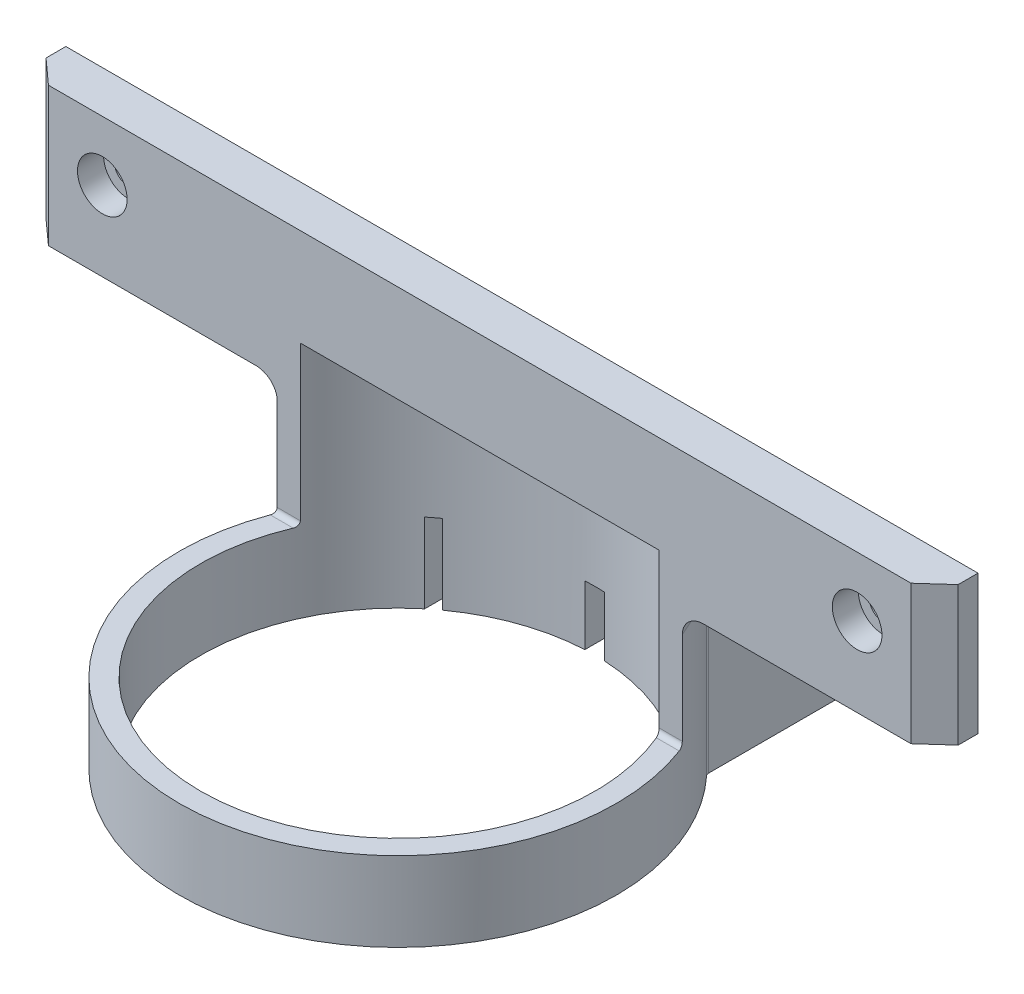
SolidWorks part; units mm, degrees
ref_plane "Front" through (0, 0, 0) normal (0, 0, 1) x (1, 0, 0)
ref_plane "Top" through (0, 0, 0) normal (0, 1, 0) x (1, 0, 0)
ref_plane "Right" through (0, 0, 0) normal (1, 0, 0) x (0, 0, -1)
ref_plane "Plane1" through (0, -72.898, 0) normal (0, 1, 0) x (-1, 0, 0)
sketch "Sketch1" plane through (0, -72.898, 0) normal (0, 1, 0) x (-1, 0, 0)
  line L0 (-23.141, 0) -> (-72.898, 0)
  line L1 (23.141, 0) -> (72.898, 0)
  line L2 (72.898, 0) -> (72.898, 3.175)
  line L3 (-72.898, 0) -> (-72.898, 3.175)
  line L4 (72.898, 3.175) -> (68.9303, 6.7475)
  line L5 (-72.898, 3.175) -> (-68.9303, 6.7475)
  line L6 (-68.9303, 6.7475) -> (68.9303, 6.7475)
  line L7 (-23.141, 0) -> (23.141, 0)
  dimension "D1" = 222
  dimension "D6" = 222
  dimension "D2" = 72.898
  dimension "D3" = 72.898
  dimension "D4" = 3.175
  dimension "D5" = 3.175
  dimension "D7" = 6.7475
extrude "Extrude1" add sketch "Sketch1" against normal blind 20.32
sketch "Sketch2" plane through (0, -93.218, 0) normal (0, -1, 0) x (1, 0, 0)
  line L0 (-68.9303, 6.7475) -> (68.9303, 6.7475) construction
  line L1 (-32.3792, 6.7475) -> (-28.675, 6.7475)
  line L2 (72.898, 0) -> (-72.898, 0) construction
  line L3 (28.675, 6.7475) -> (32.3792, 6.7475)
  arc A0 (-28.675, 6.7475) -> (28.675, 6.7475) centre (0, 19.8374) ccw
  arc A1 (-32.3792, 6.7475) -> (32.3792, 6.7475) centre (0, 19.8374) ccw
  point P5 (0, 0)
  dimension "D1" = 63.0428
  dimension "D2" = 69.85
  dimension "D6" = 19.8374
extrude "Extrude2" add sketch "Sketch2" along normal blind 20.6375
sketch "Sketch16" plane through (0, -93.218, 0) normal (0, -1, 0) x (1, 0, 0)
  line L2 (28.675, 6.7475) -> (-28.675, 6.7475)
  line L3 (-24.4965, 0) -> (24.4965, 0)
  line L4 (28.675, 6.7475) -> (-28.675, 6.7475)
  line L5 (-24.4965, 0) -> (24.4965, 0)
  arc A2 (24.4965, 0) -> (28.675, 6.7475) centre (0, 19.8374) ccw
  arc A3 (-28.675, 6.7475) -> (-24.4965, 0) centre (0, 19.8374) ccw
  arc A4 (24.4965, 0) -> (28.675, 6.7475) centre (0, 19.8374) ccw
  arc A5 (-28.675, 6.7475) -> (-24.4965, 0) centre (0, 19.8374) ccw
  dimension "D1" = 0
extrude "Extrude13" cut sketch "Sketch16" against normal blind 4.7625
sketch "Sketch17" plane through (0, -93.218, 0) normal (0, 1, 0) x (1, 0, 0)
  line L2 (24.4965, 0) -> (28.7443, 0)
  line L3 (-28.7443, 0) -> (-24.4965, 0)
  line L4 (24.4965, 0) -> (28.7443, 0)
  line L5 (-28.7443, 0) -> (-24.4965, 0)
  arc A2 (28.7443, 0) -> (-28.7443, 0) centre (0, -19.8374) ccw
  arc A3 (24.4965, 0) -> (-24.4965, 0) centre (0, -19.8374) ccw
  arc A4 (28.7443, 0) -> (-28.7443, 0) centre (0, -19.8374) ccw
  arc A5 (24.4965, 0) -> (-24.4965, 0) centre (0, -19.8374) ccw
  dimension "D1" = 0
extrude "Extrude14" add sketch "Sketch17" along normal up to surface (4.7625 mm away)
sketch "Sketch6" plane through (0, -113.8555, 0) normal (0, -1, 0) x (1, 0, 0)
  line L0 (0, -25.4) -> (25.4, -25.4) construction
  line L1 (0, -25.4) -> (-25.4, -25.4) construction
  line L2 (0, -17.4625) -> (0, 0) construction
  line L3 (-19.6616, -22.225) -> (19.6616, -22.225) construction
  line L4 (-25.4, -25.4) -> (-25.4, -4.1333) construction
  line L5 (25.4, -25.4) -> (25.4, -4.1333) construction
  line L6 (-19.6616, -22.225) -> (-19.6616, -17.4625) construction
  line L7 (-19.6616, -17.4625) -> (19.6616, -17.4625) construction
  line L8 (19.6616, -22.225) -> (19.6616, -17.4625) construction
  arc A0 (-28.675, 6.7475) -> (28.675, 6.7475) centre (0, 19.8374) ccw construction
  circle A1 centre (0, 19.8374) radius 31.5214
  arc A2 (25.4, -4.1333) -> (-25.4, -4.1333) centre (0, 19.8374) ccw
  arc A4 (-25.4, -4.1333) -> (25.4, -4.1333) centre (0, 19.8374) ccw
  dimension "D2" = 69.85
  dimension "D1" = 25.4
  dimension "D3" = 25.4
  dimension "D4" = 25.4
  dimension "D5" = 39.3232
  dimension "D6" = 4.7625
  dimension "D7" = 3.175
extrude "Extrude3" add sketch "Sketch6" along normal blind 12.7
sketch "Sketch12" plane through (0, -126.5555, 0) normal (0, -1, 0) x (1, 0, 0)
  line L0 (-25.4, -25.4) -> (-25.4, -4.1333) construction
  line L2 (25.4, -25.4) -> (25.4, -4.1333) construction
  line L3 (-25.4, -26.99) -> (-25.4, -4.1333)
  line L4 (-25.4, -26.99) -> (25.4, -26.99)
  line L5 (25.4, -26.99) -> (25.4, -4.1333)
  arc A0 (-25.4, -4.1333) -> (25.4, -4.1333) centre (0, 19.8374) ccw construction
  arc A1 (-25.4, -4.1333) -> (25.4, -4.1333) centre (0, 19.8374) ccw
  dimension "D1" = 26.99
extrude "Extrude7" add sketch "Sketch12" against normal blind 25.4
sketch "Sketch15" plane through (0, -101.1555, 0) normal (0, 1, 0) x (1, 0, 0)
  line L1 (-22.225, 26.99) -> (22.225, 26.99)
  line L2 (-25.4, 26.99) -> (25.4, 26.99) construction
  line L4 (-22.225, 4.1333) -> (-22.225, 26.99)
  line L5 (-22.225, 7.1034) -> (-22.225, 26.99)
  line L7 (22.225, 26.99) -> (22.225, 4.1333)
  line L8 (22.225, 26.99) -> (22.225, 7.1034)
  arc A1 (22.225, 7.1034) -> (-22.225, 7.1034) centre (0, -19.8374) ccw
  arc A2 (25.4, 4.1333) -> (-25.4, 4.1333) centre (0, -19.8374) ccw construction
  dimension "D1" = 3.175
  dimension "D2" = 3.175
extrude "Extrude12" cut sketch "Sketch15" against normal blind 15.875
sketch "Sketch13" plane through (0, -126.5555, 0) normal (0, -1, 0) x (1, 0, 0)
  line L0 (22.225, -26.99) -> (-22.225, -26.99) construction
  line L4 (20.0343, -22.225) -> (20.0343, -16.2751)
  line L5 (-20.0343, -22.225) -> (20.0343, -22.225)
  line L6 (0, -16.2751) -> (0, 0) construction
  line L7 (-20.0343, -22.225) -> (-20.0343, -16.2751)
  line L11 (-20.0343, -16.2751) -> (20.0343, -16.2751)
  point P10 (-18.0741, -22.225)
  point P11 (-18.0741, -9.0274)
  dimension "D1" = 20.0342
  dimension "D2" = 5.95
  dimension "D3" = 16.2751
  dimension "D4" = 5.9499
  dimension "D5" = 4.765
  dimension "D6" = 20.0343
  dimension "D7" = 40.0685
extrude "Extrude10" cut sketch "Sketch13" against normal up to next
sketch "Sketch7" plane through (0, 0, 0) normal (1, 0, 0) x (0, 0, -1)
  line L1 (-14.3022, -112.268) -> (16.2751, -112.268)
  line L2 (-14.3022, -112.268) -> (-14.3022, -113.8555)
  line L3 (-14.3022, -113.8555) -> (16.2751, -113.8555)
  line L4 (16.2751, -112.268) -> (16.2751, -113.8555)
  line L5 (-6.7475, -113.8555) -> (-54.7624, -113.8555) construction
  line L6 (16.2751, -117.0305) -> (16.2751, -126.5555) construction
  dimension "D1" = 1.5875
extrude "Extrude4" [suppressed] cut sketch "Sketch7" along normal through all and the other way up to surface
sketch "Sketch14" plane through (0, -126.5555, 0) normal (0, -1, 0) x (1, 0, 0)
  line L0 (0, -20.3452) -> (0, 0) construction
  line L1 (-1.5875, -20.3452) -> (1.5875, -20.3452) construction
  line L2 (-1.5875, -20.3452) -> (-1.5875, 15.7132) construction
  line L3 (-1.5875, 15.7132) -> (1.5875, 15.7132) construction
  line L4 (1.5875, -20.3452) -> (1.5875, 15.7132) construction
  line L5 (20.0343, -16.2751) -> (20.0343, -4.4983)
  line L6 (20.0343, -16.2751) -> (18.4392, -16.2751)
  line L7 (20.0343, -16.2751) -> (-20.0343, -16.2751) construction
  line L8 (18.4392, -16.2751) -> (18.4392, -5.7281)
  line L11 (-20.0343, -16.2751) -> (-20.0342, -4.4983)
  line L12 (-18.4468, -16.2751) -> (-18.4468, -5.7226)
  line L13 (-20.0343, -16.2751) -> (-18.4468, -16.2751)
  line L14 (-20.0343, -16.2751) -> (-20.0343, -22.225) construction
  line L15 (20.0343, -16.2751) -> (-20.0343, -16.2751) construction
  arc A1 (-24.4965, 0) -> (24.4965, 0) centre (0, 19.8374) ccw construction
  arc A2 (-20.0342, -4.4983) -> (-18.4468, -5.7226) centre (0, 19.8374) ccw
  arc A3 (18.4392, -5.7281) -> (20.0343, -4.4983) centre (0, 19.8374) ccw
  dimension "D1" = 3.175
  dimension "D3" = 1.5951
  dimension "D4" = 1.5875
extrude "Extrude11" cut sketch "Sketch14" against normal up to surface (12.7 mm away)
sketch "Sketch19" plane through (0, -126.5555, 0) normal (0, -1, 0) x (1, 0, 0)
  line L0 (0, -5.7188) -> (0, 0) construction
  line L1 (1.5875, -18.1775) -> (-1.5875, -18.1775)
  line L2 (1.5875, -18.1775) -> (1.5875, -5.7188)
  line L3 (1.5875, -5.7188) -> (-1.5875, -5.7188)
  line L4 (-1.5875, -18.1775) -> (-1.5875, -5.7188)
  dimension "D1" = 3.175
extrude "Extrude16" cut sketch "Sketch19" against normal up to surface (9.525 mm away)
sketch "Sketch18" plane through (0, 0, 0) normal (1, 0, 0) x (0, 0, -1)
  line L0 (11.684, -88.4555) -> (19.6959, -98.0037)
  line L1 (19.6959, -98.0037) -> (19.6959, -88.4555)
  line L2 (19.6959, -88.4555) -> (11.684, -88.4555)
  dimension "D1" = 50
extrude "Extrude15" cut sketch "Sketch18" against normal mid plane 57.9438
hole_wizard "CBORE for #8 Socket Head Cap Screw1" positions "Sketch5" profile "Sketch4" counterbore size "#8" standard "Ansi Inch"
sketch "Sketch5" plane through (0, 0, 6.7475) normal (0, 0, 1) x (1, 0, 0)
  line L0 (50, -72.898) -> (-50, -72.898) construction
  point P0 (60.325, -82.423)
  point P1 (-60.325, -82.423)
  dimension "D1" = 9.525
  dimension "D2" = 60.325
  dimension "D3" = 60.325
sketch "Sketch4" plane through (60.325, -82.423, 6.7475) normal (1, 0, 0) x (0, -1, 0)
  line L0 (0, 0) -> (0, 33.7375)
  line L1 (0, 33.7375) -> (2.2479, 33.7375)
  line L3 (2.2479, 33.7375) -> (2.2479, 4.1656)
  line L4 (2.2479, 4.1656) -> (3.9687, 4.1656)
  line L5 (3.9687, 4.1656) -> (3.9688, 0)
  line L7 (3.9688, 0) -> (0, 0)
  line L11 (0, -6.35) -> (0, 107.95) construction
  dimension "Thru Hole Dia." = 4.4958
  dimension "Thru Hole Depth" = 33.7375
  dimension "C'Bore Dia." = 7.9375
  dimension "C'Bore Depth" = 4.1656
sketch "Sketch22" plane through (0, -93.218, 0) normal (0, -1, 0) x (1, 0, 0)
  line L0 (32.3792, 6.7475) -> (68.9303, 6.7475) construction
  line L1 (68.9303, 6.7475) -> (72.898, 3.175) construction
  line L2 (72.898, 3.175) -> (72.898, 0) construction
  line L3 (72.898, 0) -> (28.7443, 0) construction
  line L4 (-32.3792, 6.7475) -> (-68.9303, 6.7475)
  line L5 (-68.9303, 6.7475) -> (-72.898, 3.175)
  line L6 (-72.898, 3.175) -> (-72.898, 0)
  line L7 (-72.898, 0) -> (-28.7443, 0)
  line L8 (-32.3792, 6.7475) -> (-68.9303, 6.7475)
  line L9 (-68.9303, 6.7475) -> (-72.898, 3.175)
  line L10 (-72.898, 3.175) -> (-72.898, 0)
  line L11 (-72.898, 0) -> (-28.7443, 0)
  line L12 (32.3792, 6.7475) -> (68.9303, 6.7475)
  line L13 (68.9303, 6.7475) -> (72.898, 3.175)
  line L14 (72.898, 3.175) -> (72.898, 0)
  line L15 (72.898, 0) -> (28.7443, 0)
  arc A0 (28.7443, 0) -> (32.3792, 6.7475) centre (0, 19.8374) ccw construction
  arc A1 (-32.3792, 6.7475) -> (-28.7443, 0) centre (0, 19.8374) ccw
  arc A2 (-32.3792, 6.7475) -> (-28.7443, 0) centre (0, 19.8374) ccw
  arc A3 (28.7443, 0) -> (32.3792, 6.7475) centre (0, 19.8374) ccw
  dimension "D1" = 0
extrude "Boss-Extrude_RevA" add sketch "Sketch22" along normal blind 1.905
fillet "Fillet6" radius 3.175 2 edges at (-22.225, -109.093, -7.1034) (22.225, -109.093, -7.1034)
fillet "Fillet1" radius 0.7937 8 edges at (25.4, -113.8555, -4.1333) (-25.4, -113.8555, -4.1333) (28.7443, -91.7893, 0) (-28.7443, -91.7893, 0) (20.0343, -121.793, -22.225) (-20.0343, -121.793, -22.225)
fillet "Fillet2" radius 0.127 7 edges at (-26.8272, -88.4555, 0) (-22.225, -117.0305, -20.0741) (22.225, -117.0305, -20.0741) (-21.781, -101.1555, -7.4636) (21.781, -101.1555, -7.4636) (-21.6196, -117.0305, -11.2933) (21.6196, -117.0305, -11.2933)
fillet "Fillet3" radius 0.127 1 edges at (-26.7989, -88.4555, 3.2417)
fillet "Fillet4" radius 0.127 1 edges at (26.7989, -88.4555, 3.2417)
fillet "Fillet5" radius 0.127 1 edges at (26.8272, -88.4555, 0)
fillet "Fillet7" radius 3.175 2 edges at (-30.6499, -95.123, 3.094) (30.6499, -95.123, 3.094)
sketch "Sketch20" plane through (0, 0, 0) normal (1, 0, 0) x (0, 0, -1)
  line L1 (-80.5295, -28.9091) -> (60.7276, -28.9091)
  line L2 (-80.5295, -28.9091) -> (-80.5295, -160.6504)
  line L3 (-80.5295, -160.6504) -> (60.7276, -160.6504)
  line L4 (60.7276, -28.9091) -> (60.7276, -160.6504)
extrude "FEA" [suppressed] cut sketch "Sketch20" along normal through all
equation "\"Buoyancy\"=\"SW-Volume\"*(\"SW-Density\"-.037062)"
